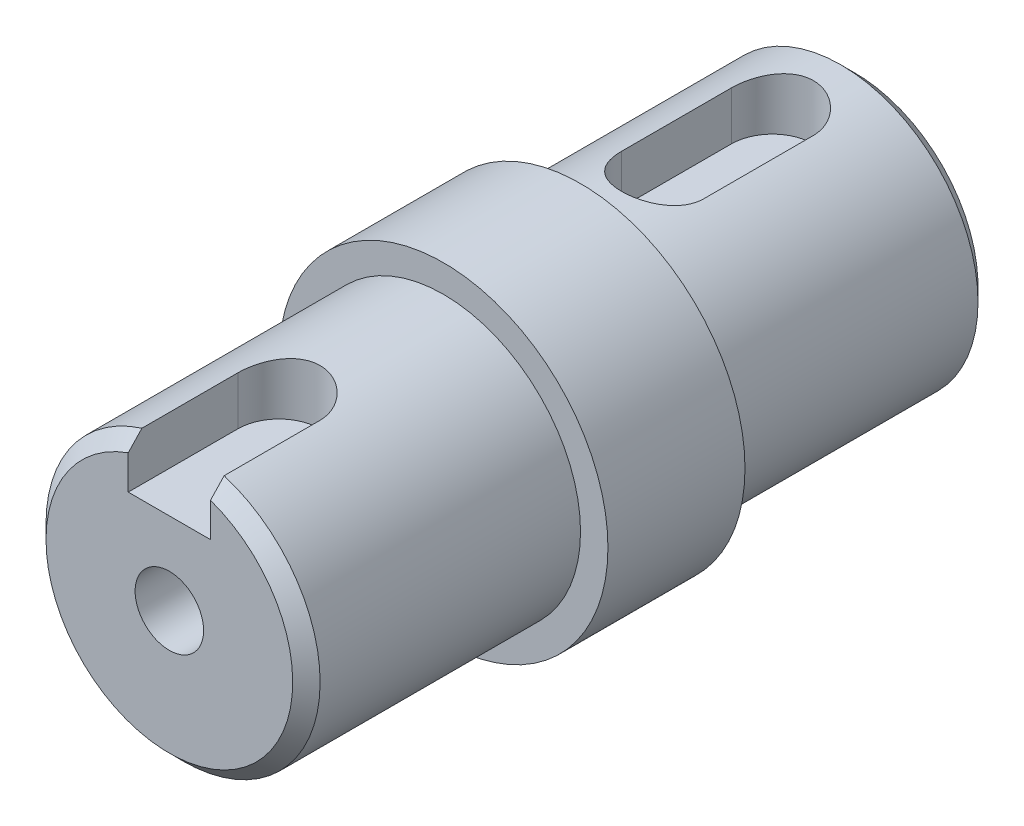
SolidWorks part; units mm, degrees
ref_plane "Plan de face" through (0, 0, 0) normal (0, 0, 1) x (1, 0, 0)
ref_plane "Plan de dessus" through (0, 0, 0) normal (0, 1, 0) x (1, 0, 0)
ref_plane "Plan de droite" through (0, 0, 0) normal (1, 0, 0) x (0, 0, -1)
sketch "Esquisse1" plane through (0, 0, 0) normal (0, 0, 1) x (1, 0, 0)
  circle A0 centre (0, 0) radius 5
  dimension "D1" = 10
extrude "Boss.-Extru.1" add sketch "Esquisse1" along normal blind 10
sketch "Esquisse2" plane through (0, 0, 0) normal (0, 0, -1) x (-1, 0, 0)
  circle A0 centre (0, 0) radius 6
  dimension "D1" = 12
extrude "Boss.-Extru.2" add sketch "Esquisse2" along normal blind 5
sketch "Esquisse3" plane through (0, 0, -5) normal (0, 0, -1) x (-1, 0, 0)
  circle A0 centre (0, 0) radius 5
  dimension "D1" = 10
extrude "Boss.-Extru.3" add sketch "Esquisse3" along normal blind 10
ref_plane "Plan1" through (0, 3, 0) normal (0, 1, 0) x (1, 0, 0)
sketch "Esquisse4" plane through (0, 3, 0) normal (0, 1, 0) x (1, 0, 0)
  line L0 (0, 12) -> (0, 8) construction
  line L1 (1.5, 12) -> (1.5, 8)
  line L2 (-1.5, 12) -> (-1.5, 8)
  line L3 (0, -12.4017) -> (0, -6) construction
  line L4 (-1.5, -12.4017) -> (-1.5, -6)
  line L5 (1.5, -12.4017) -> (1.5, -6)
  line L6 (6, 5) -> (-6, 5) construction
  line L7 (-5, -10) -> (5, -10) construction
  arc A0 (1.5, 12) -> (-1.5, 12) centre (0, 12) ccw
  arc A1 (-1.5, 8) -> (1.5, 8) centre (0, 8) ccw
  arc A2 (-1.5, -12.4017) -> (1.5, -12.4017) centre (0, -12.4017) ccw
  arc A3 (1.5, -6) -> (-1.5, -6) centre (0, -6) ccw
  point P2 (0, 10)
  point P8 (0, -9.2008)
  dimension "D2" = 3
  dimension "D4" = 1.5
  dimension "D1" = 4
  dimension "D3" = 3
  dimension "D5" = 4
extrude "Enlèv. mat.-Extru.1" cut sketch "Esquisse4" along normal blind 9
chamfer "Chanfrein1" distance 0.5 angle 45 2 edges at (-5, 0, -15) (0, -5, 10)
hole_wizard "Trou taraudé M3x0.51" positions "Esquisse6" profile "Esquisse5" tap size "M3x0.5" standard "Ansi Metric"
sketch "Esquisse6" plane through (0, 0, 10) normal (0, 0, 1) x (1, 0, 0)
  point P0 (0, 0)
sketch "Esquisse5" plane through (0, 0, 10) normal (1, 0, 0) x (0, -1, 0)
  line L0 (0, 0) -> (0, 9.2511)
  line L1 (0, 9.2511) -> (1.25, 8.5)
  line L2 (1.25, 8.5) -> (1.25, 0)
  line L5 (1.25, 0) -> (0, 0)
  line L10 (0, 9.2511) -> (-1.25, 8.5) construction
  line L11 (0, -6.35) -> (0, 107.95) construction
  dimension "Diamètre du trou pour taraudage" = 2.5
  dimension "Profondeur du trou pour taraudage" = 8.5
  dimension "Angle de pointe" = 118
